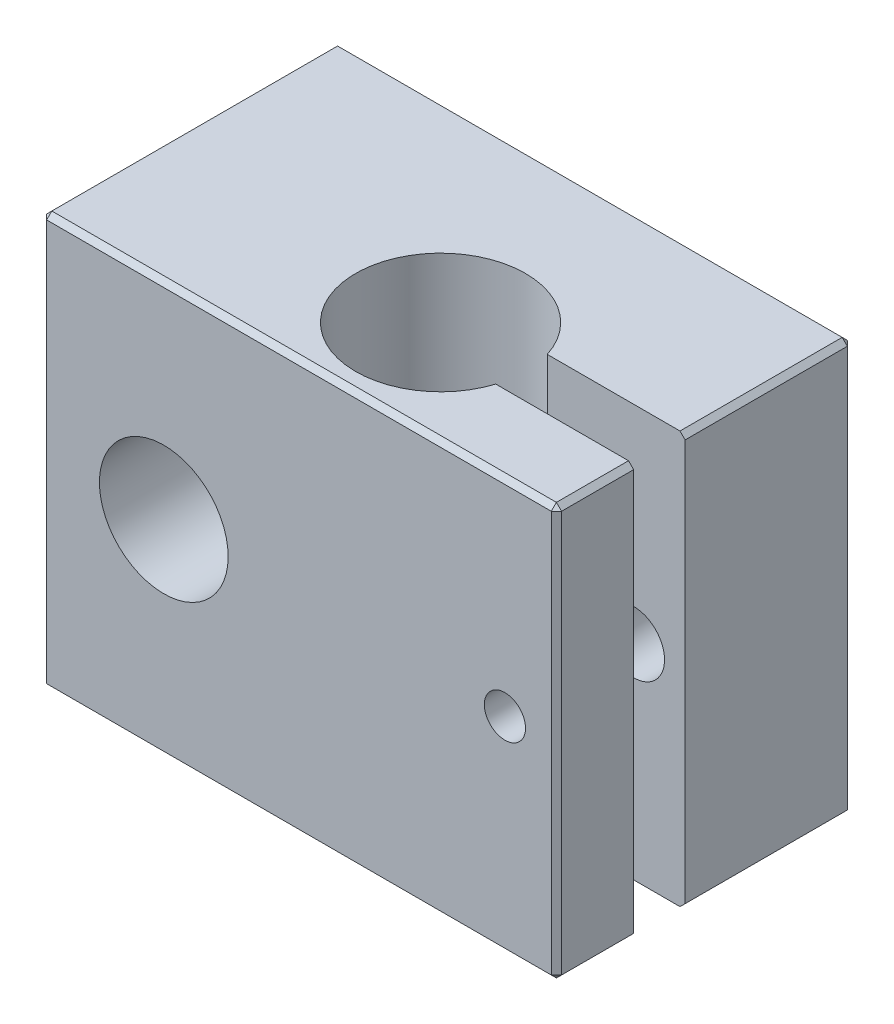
SolidWorks part; units mm, degrees
ref_plane "Plan de face" through (0, 0, 0) normal (0, 0, 1) x (1, 0, 0)
ref_plane "Plan de dessus" through (0, 0, 0) normal (0, 1, 0) x (1, 0, 0)
ref_plane "Plan de droite" through (0, 0, 0) normal (1, 0, 0) x (0, 0, -1)
sketch "Esquisse1" plane through (0, 0, 0) normal (0, 0, 1) x (1, 0, 0)
  line L1 (-4.75, 8) -> (15.25, 8)
  line L2 (-4.75, 8) -> (-4.75, -8)
  line L3 (-4.75, -8) -> (15.25, -8)
  line L4 (15.25, 8) -> (15.25, -8)
  dimension "D1" = 8
  dimension "D2" = 16
  dimension "D3" = 20
  dimension "D4" = 4.75
extrude "Boss.-Extru.1" add sketch "Esquisse1" along normal blind 11.5
hole_wizard "Trou taraudé M61" positions "Esquisse3" profile "Esquisse2" tap size "M6" standard "Iso"
sketch "Esquisse3" plane through (0, 0, 11.5) normal (0, 0, 1) x (1, 0, 0)
  point P0 (0, 0)
sketch "Esquisse2" plane through (0, 0, 11.5) normal (1, 0, 0) x (0, -1, 0)
  line L0 (0, 0) -> (0, 11.5)
  line L1 (0, 11.5) -> (2.5, 11.5)
  line L2 (2.5, 11.5) -> (2.5, 0)
  line L5 (2.5, 0) -> (0, 0)
  line L11 (0, -6.35) -> (0, 107.95) construction
  dimension "Diamètre du trou pour taraudage jusqu'au prochain" = 5
  dimension "Profondeur du trou pour taraudage jusqu'au prochain" = 11.5
hole_wizard "Perçage1" positions "Esquisse5" profile "Esquisse4" legacy
sketch "Esquisse5" plane through (0, -8, 0) normal (0, -1, 0) x (-1, 0, 0)
  line L0 (4.75, -11.5) -> (4.75, 0) construction
  line L1 (4.75, -11.5) -> (-15.25, -11.5) construction
  point P0 (2.25, -9)
sketch "Esquisse4" plane through (-2.25, -8, 9) normal (1, 0, 0) x (0, 0, -1)
  line L0 (0, 0) -> (0, 4.5)
  line L1 (0, 4.5) -> (0.5, 4.5)
  line L2 (0.5, 4.5) -> (0.5, 2)
  line L3 (0.5, 2) -> (1, 2)
  line L4 (1, 2) -> (1, 0)
  line L5 (1, 0) -> (0, 0)
  line L6 (0, 110) -> (0, -10) construction
  dimension "Diamètre" = 1
  dimension "Profondeur" = 4.5
  dimension "Diamètre chambrage" = 2
  dimension "Profondeur chambrage" = 2
hole_wizard "Trou taraudé M2.51" positions "Esquisse7" profile "Esquisse6" tap size "M2.5" standard "Iso"
sketch "Esquisse7" plane through (0, -8, 0) normal (0, -1, 0) x (-1, 0, 0)
  line L0 (4.75, -11.5) -> (4.75, 0) construction
  line L1 (4.75, -11.5) -> (-15.25, -11.5) construction
  point P0 (1.25, -6.5)
  dimension "D1" = 3.5
  dimension "D2" = 5
sketch "Esquisse6" plane through (-1.25, -8, 6.5) normal (1, 0, 0) x (0, 0, -1)
  line L0 (0, 0) -> (0, 5.1159)
  line L1 (0, 5.1159) -> (1.025, 4.5)
  line L2 (1.025, 4.5) -> (1.025, 0)
  line L5 (1.025, 0) -> (0, 0)
  line L10 (0, 5.1159) -> (-1.025, 4.5) construction
  line L11 (0, -6.35) -> (0, 107.95) construction
  dimension "Diamètre du trou pour taraudage" = 2.05
  dimension "Profondeur du trou pour taraudage" = 4.5
  dimension "Angle de pointe" = 118
hole_wizard "Dégagement M61" positions "Esquisse9" profile "Esquisse8" hole size "M6" standard "Ansi Metric"
sketch "Esquisse9" plane through (0, -8, 0) normal (0, -1, 0) x (-1, 0, 0)
  line L0 (4.75, -11.5) -> (4.75, 0) construction
  line L1 (4.75, -11.5) -> (-15.25, -11.5) construction
  point P0 (-6.75, -7.5)
  dimension "D1" = 11.5
  dimension "D2" = 4
sketch "Esquisse8" plane through (6.75, -8, 7.5) normal (1, 0, 0) x (0, 0, -1)
  line L0 (0, 0) -> (0, 16)
  line L1 (0, 16) -> (3.3, 16)
  line L2 (3.3, 16) -> (3.3, 0)
  line L5 (3.3, 0) -> (0, 0)
  line L11 (0, -6.35) -> (0, 107.95) construction
  dimension "Diamètre du perçage jusqu'au prochain" = 6.6
  dimension "Profondeur du perçage jusqu'au prochain" = 16
sketch "Esquisse10" plane through (0, -8, 0) normal (0, -1, 0) x (1, 0, 0)
  line L0 (3.45, 7.5) -> (22.5625, 7.5) construction
  line L2 (6.75, 8.5) -> (18.2372, 8.5)
  line L3 (6.75, 8.5) -> (6.75, 6.5)
  line L4 (6.75, 6.5) -> (18.2372, 6.5)
  line L5 (18.2372, 8.5) -> (18.2372, 6.5)
extrude "Enlèv. mat.-Extru.1" cut sketch "Esquisse10" against normal through all
hole_wizard "Trou taraudé M21" positions "Esquisse12" profile "Esquisse11" tap size "M2" standard "Iso"
sketch "Esquisse12" plane through (0, 0, 11.5) normal (0, 0, 1) x (1, 0, 0)
  line L1 (15.25, -8) -> (15.25, 8) construction
  point P0 (13.25, 0)
  dimension "D1" = 2
sketch "Esquisse11" plane through (13.25, 0, 11.5) normal (1, 0, 0) x (0, -1, 0)
  line L0 (0, 0) -> (0, 3)
  line L1 (0, 3) -> (0.8, 3)
  line L2 (0.8, 3) -> (0.8, 0)
  line L5 (0.8, 0) -> (0, 0)
  line L11 (0, -6.35) -> (0, 107.95) construction
  dimension "Diamètre du trou pour taraudage jusqu'au prochain" = 1.6
  dimension "Profondeur du trou pour taraudage jusqu'au prochain" = 3
hole_wizard "Dégagement M21" positions "Esquisse16" profile "Esquisse15" hole size "M2" standard "Ansi Metric"
sketch "Esquisse16" plane through (0, 0, 0) normal (0, 0, -1) x (-1, 0, 0)
  line L0 (-15.25, -8) -> (-15.25, 8) construction
  point P0 (-13.25, 0)
  dimension "D1" = 2
sketch "Esquisse15" plane through (13.25, 0, 0) normal (1, 0, 0) x (0, 1, 0)
  line L0 (0, 0) -> (0, 6.5)
  line L1 (0, 6.5) -> (1.2, 6.5)
  line L2 (1.2, 6.5) -> (1.2, 0)
  line L5 (1.2, 0) -> (0, 0)
  line L11 (0, -6.35) -> (0, 107.95) construction
  dimension "Diamètre du perçage jusqu'au prochain" = 2.4
  dimension "Profondeur du perçage jusqu'au prochain" = 6.5
chamfer "Chanfrein1" distance 0.2 angle 45 14 edges at (5.25, -8, 0) (-4.75, -8, 5.75) (-4.75, 0, 0) (15.25, -8, 3.25) (15.25, 0, 0) (15.25, 8, 3.25) (5.25, 8, 0) (-4.75, 8, 5.75) (15.25, -8, 10) (15.25, 8, 10) (5.25, -8, 11.5) (15.25, 0, 11.5) (5.25, 8, 11.5) (-4.75, 0, 11.5)
equation "\"D2@Esquisse5\"=\"D1@Esquisse5\""
equation "\"D2@Esquisse10\"=\"D1@Esquisse10\""
